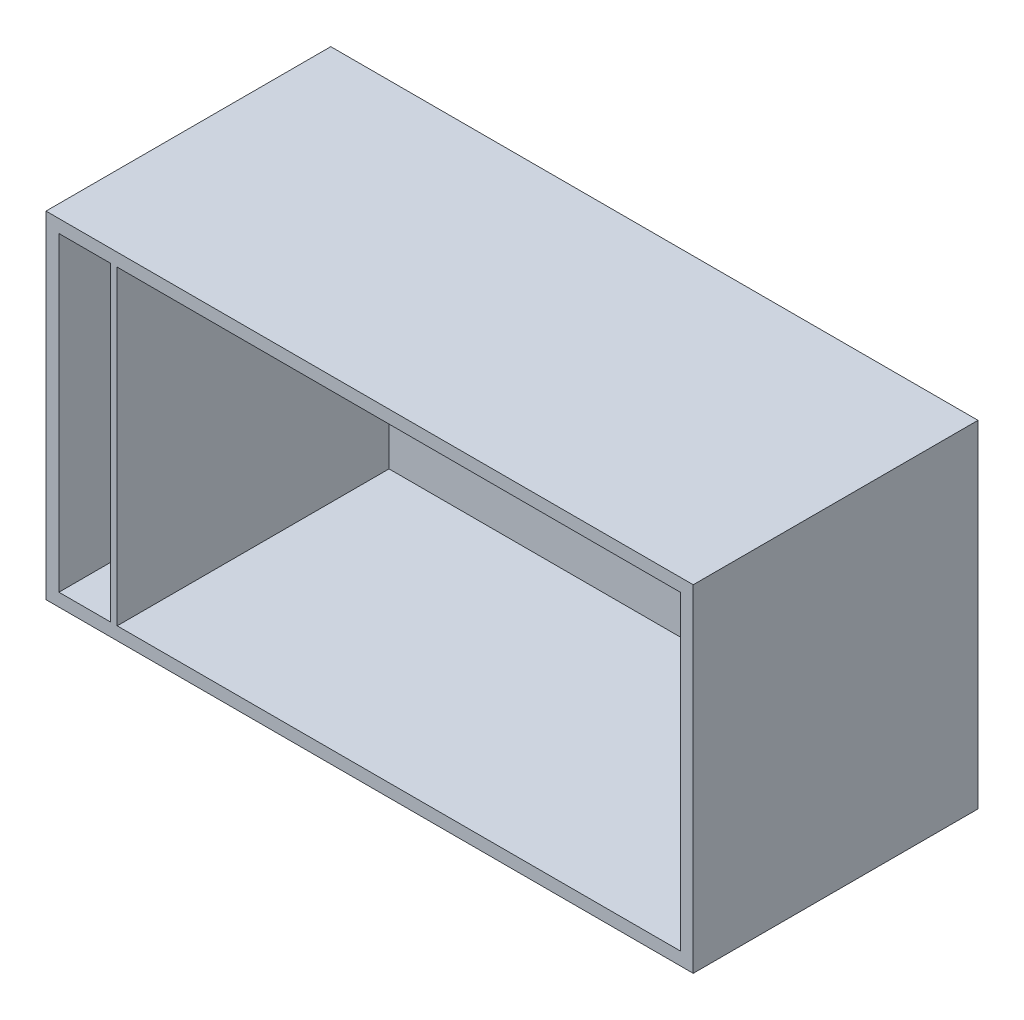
SolidWorks part; units mm, degrees
ref_plane "Front Plane" through (0, 0, 0) normal (0, 0, 1) x (1, 0, 0)
ref_plane "Top Plane" through (0, 0, 0) normal (0, 1, 0) x (1, 0, 0)
ref_plane "Right Plane" through (0, 0, 0) normal (1, 0, 0) x (0, 0, -1)
sketch "Sketch1" plane through (0, 0, 0) normal (0, 0, 1) x (1, 0, 0)
  line L0 (-12.7, -12.7) -> (622.3, -12.7)
  line L1 (0, 0) -> (609.6, 0)
  line L2 (0, 0) -> (0, 304.8)
  line L3 (0, 304.8) -> (609.6, 304.8)
  line L4 (609.6, 0) -> (609.6, 304.8)
  line L5 (622.3, -12.7) -> (622.3, 317.5)
  line L6 (-12.7, 317.5) -> (622.3, 317.5)
  line L7 (-12.7, -12.7) -> (-12.7, 317.5)
  dimension "D1" = 609.6
  dimension "D2" = 304.8
  dimension "D3" = 12.7
extrude "Extrude1" add sketch "Sketch1" along normal blind 266.7
sketch "Sketch2" plane through (0, 0, 0) normal (0, 0, -1) x (-1, 0, 0)
  line L1 (-622.3, 317.5) -> (12.7, 317.5)
  line L2 (-622.3, 317.5) -> (-622.3, -12.7)
  line L3 (-622.3, -12.7) -> (12.7, -12.7)
  line L4 (12.7, 317.5) -> (12.7, -12.7)
extrude "Extrude2" add sketch "Sketch2" along normal blind 12.7
sketch "Sketch3" plane through (0, 0, 0) normal (0, 0, 1) x (1, 0, 0)
  line L0 (609.6, 304.8) -> (0, 304.8) construction
  line L1 (50.8, 304.8) -> (57.15, 304.8)
  line L2 (50.8, 304.8) -> (50.8, 0)
  line L3 (50.8, 0) -> (57.15, 0)
  line L4 (57.15, 304.8) -> (57.15, 0)
  line L5 (0, 304.8) -> (0, 0) construction
  dimension "D1" = 50.8
  dimension "D2" = 6.35
extrude "Extrude3" add sketch "Sketch3" along normal up to surface (266.7 mm away)
